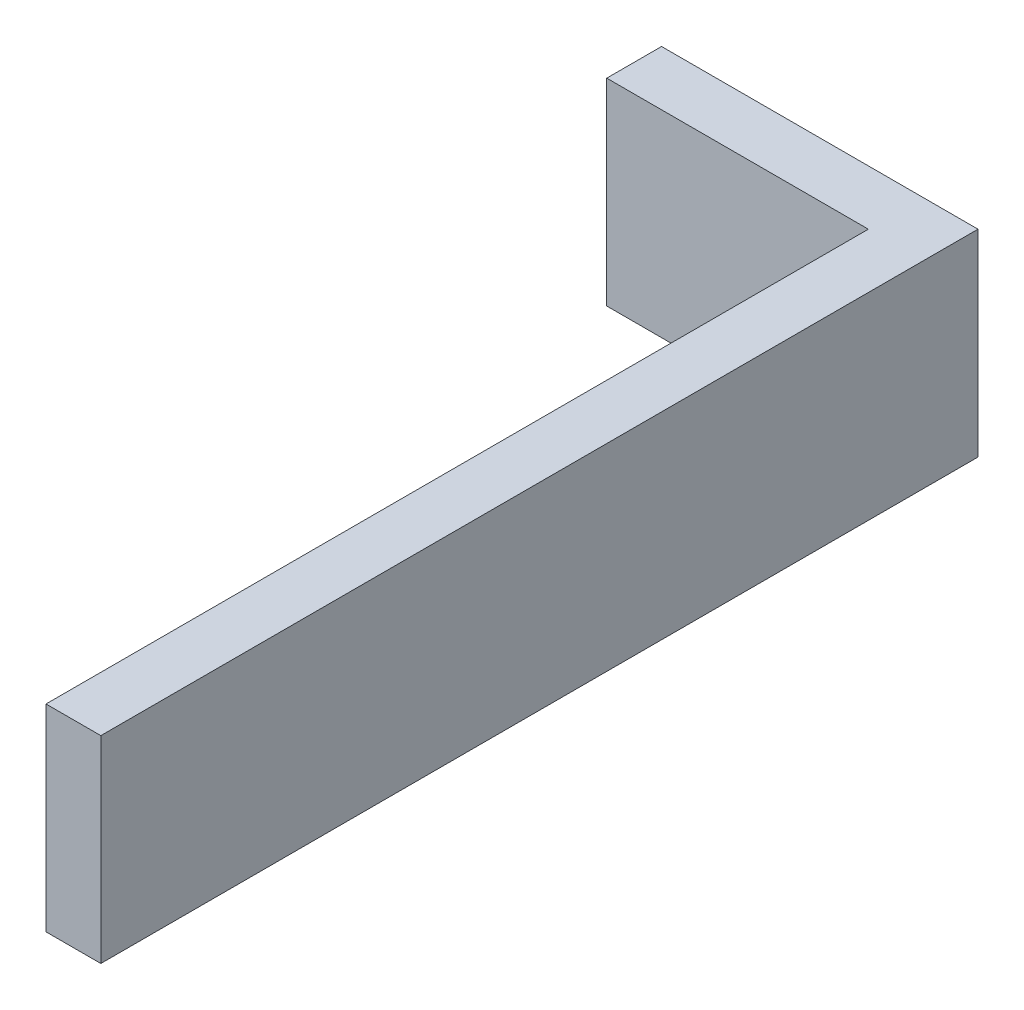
SolidWorks part; units mm, degrees
ref_plane "Front Plane" through (0, 0, 0) normal (0, 0, 1) x (1, 0, 0)
ref_plane "Top Plane" through (0, 0, 0) normal (0, 1, 0) x (1, 0, 0)
ref_plane "Right Plane" through (0, 0, 0) normal (1, 0, 0) x (0, 0, -1)
sketch "Sketch2" plane through (0, 0, 0) normal (0, 1, 0) x (1, 0, 0)
  line L0 (-18.3261, 0) -> (0, 0)
  line L1 (0, 0) -> (0, -50.8)
  dimension "D1" = 18.3261
  dimension "D2" = 50.8
extrude "Extrude-Thin1" add sketch "Sketch2" along normal blind 11.43 thin
